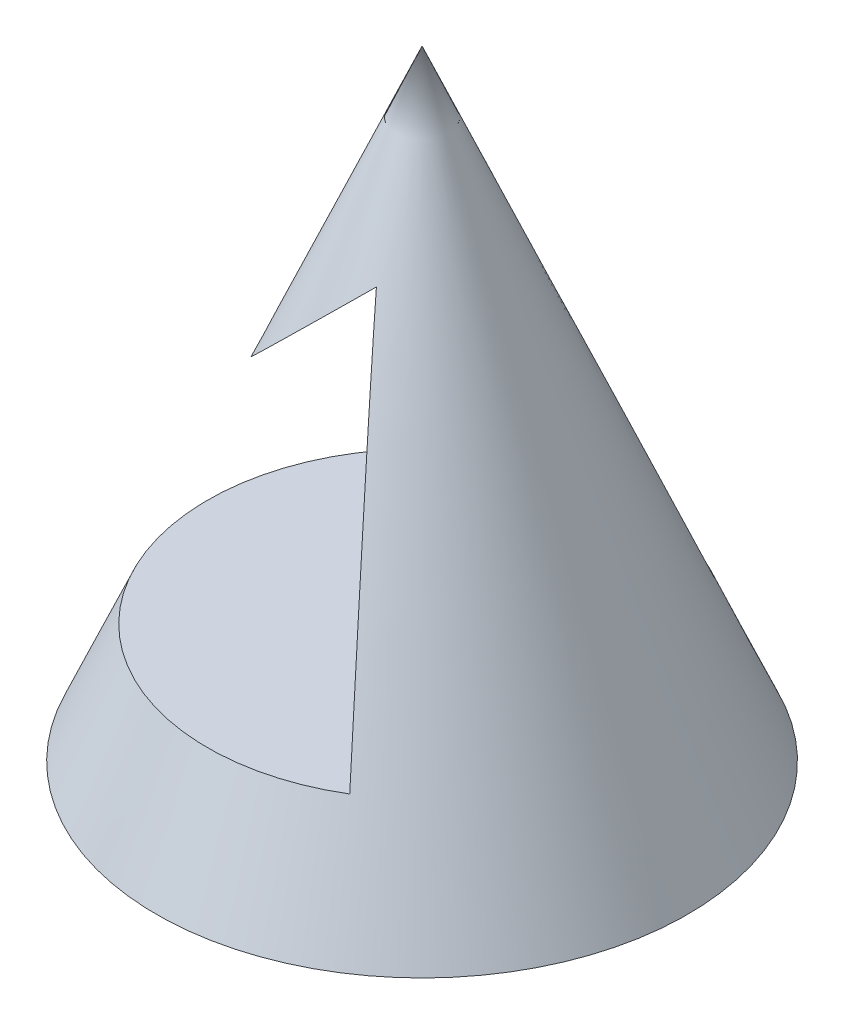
SolidWorks part; units mm, degrees
ref_plane "前视基准面" through (0, 0, 0) normal (0, 0, 1) x (1, 0, 0)
ref_plane "上视基准面" through (0, 0, 0) normal (0, 1, 0) x (1, 0, 0)
ref_plane "右视基准面" through (0, 0, 0) normal (1, 0, 0) x (0, 0, -1)
sketch "草图1" plane through (0, 0, 0) normal (1, 0, 0) x (0, 0, -1)
  line L0 (0, 0) -> (0, 81.0411) construction
  line L1 (0, 0) -> (30, 0)
  line L2 (30, 0) -> (0, 70)
  line L3 (0, 70) -> (0, 0)
  dimension "D1" = 30
  dimension "D2" = 70
revolve "旋转1" add sketch "草图1" angle 360 about L0
sketch "草图2" plane through (0, 0, 0) normal (0, 0, 1) x (1, 0, 0)
  line L0 (-36.2378, 13.441) -> (12.5579, 13.441)
  line L1 (12.5579, 13.441) -> (2.424, 51.4225)
  line L2 (2.424, 51.4225) -> (-36.2378, 13.441)
  point P2 (1.962, 48.7957)
  point P4 (11.5088, 15.6441)
  point P5 (3.0111, 49.1104)
  point P6 (12.5579, 13.441)
extrude "切除-拉伸1" cut sketch "草图2" against normal through all both and the other way through all
